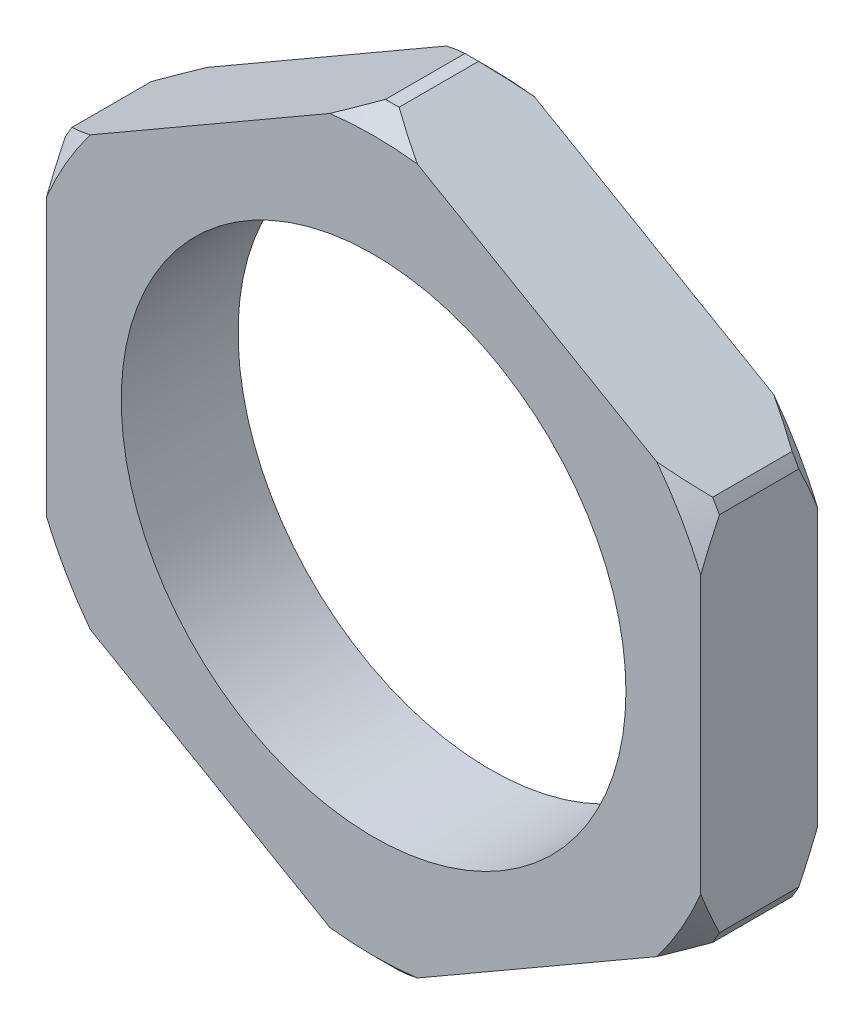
SolidWorks part; units mm, degrees
ref_plane "Plan de face" through (0, 0, 0) normal (0, 0, 1) x (1, 0, 0)
ref_plane "Plan de dessus" through (0, 0, 0) normal (0, 1, 0) x (1, 0, 0)
ref_plane "Plan de droite" through (0, 0, 0) normal (1, 0, 0) x (0, 0, -1)
sketch "Esquisse4" plane through (0, 0, 0) normal (0, 0, 1) x (1, 0, 0)
  circle A0 centre (0, 0) radius 8
  dimension "D1" = 16
extrude "Boss.-Extru.2" add sketch "Esquisse4" along normal blind 2.5
chamfer "Chanfrein1" distance 0.4 angle 45 2 edges at (8, 0, 2.5) (8, 0, 0)
sketch "Esquisse5" plane through (0, 0, 2.5) normal (0, 0, 1) x (1, 0, 0)
  line L4 (0, 8.0829) -> (-7, 4.0415)
  line L5 (-7, 4.0415) -> (-7, -4.0415)
  line L6 (-7, -4.0415) -> (0, -8.0829)
  line L7 (0, -8.0829) -> (7, -4.0415)
  line L8 (7, -4.0415) -> (7, 4.0415)
  line L9 (7, 4.0415) -> (0, 8.0829)
  circle A0 centre (0, 0) radius 7 construction
  point P0 (0, 8.3413)
  dimension "D1" = 14
extrude "Enlèv. mat.-Extru.2" cut sketch "Esquisse5" against normal through all flip side to cut
sketch "Esquisse6" plane through (0, 0, 2.5) normal (0, 0, 1) x (1, 0, 0)
  circle A0 centre (0, 0) radius 5.4
  dimension "D1" = 10.8
extrude "Enlèv. mat.-Extru.3" cut sketch "Esquisse6" against normal through all
sketch "Esquisse1" plane through (0, 0, 0) normal (0, 0, 1) x (1, 0, 0)
  line L1 (-8.0829, 0) -> (-4.0415, -7)
  line L2 (-4.0415, -7) -> (4.0415, -7)
  line L3 (4.0415, -7) -> (8.0829, 0)
  line L4 (8.0829, 0) -> (4.0415, 7)
  line L5 (4.0415, 7) -> (-4.0415, 7)
  line L6 (-4.0415, 7) -> (-8.0829, 0)
  circle A0 centre (0, 0) radius 7 construction
  dimension "D1" = 14
extrude "Boss.-Extru.1" add sketch "Esquisse1" along normal blind 2.5
sketch "Esquisse2" plane through (0, 0, 2.5) normal (0, 0, 1) x (1, 0, 0)
  circle A0 centre (0, 0) radius 5.4
  dimension "D1" = 10.8
extrude "Enlèv. mat.-Extru.1" cut sketch "Esquisse2" against normal through all
